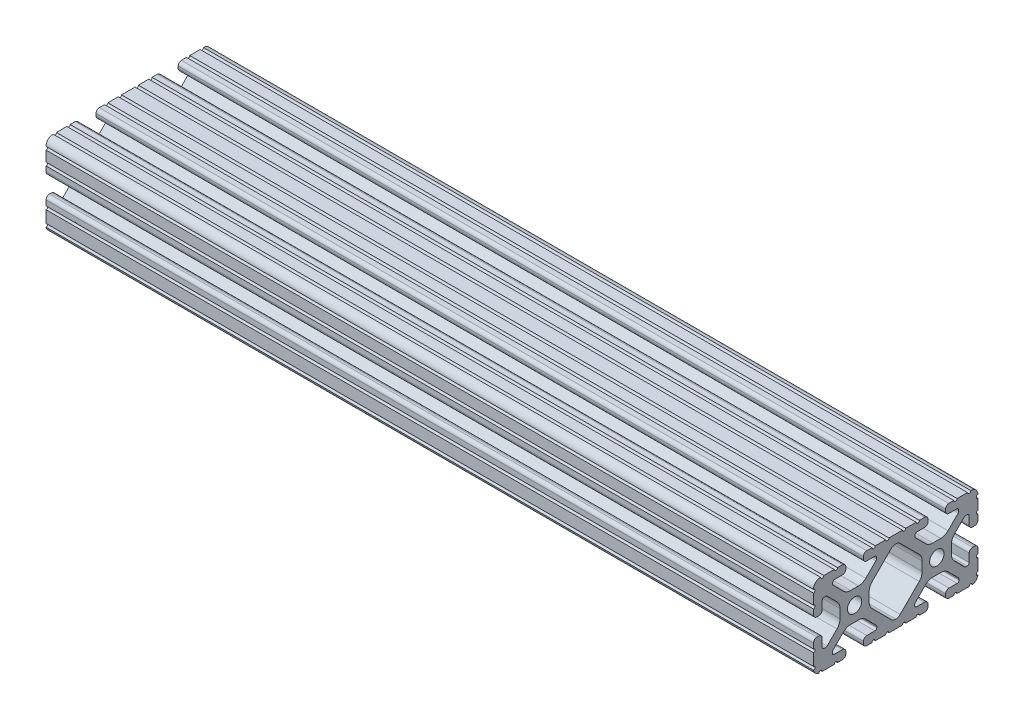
SolidWorks part; units mm, degrees
ref_plane "Front" through (0, 0, 0) normal (0, 0, 1) x (1, 0, 0)
ref_plane "Top" through (0, 0, 0) normal (0, 1, 0) x (1, 0, 0)
ref_plane "Right" through (0, 0, 0) normal (1, 0, 0) x (0, 0, -1)
sketch "Sketch1" plane through (0, 0, 0) normal (1, 0, 0) x (0, 0, -1)
  line L2 (30.3513, 26.5282) -> (39.1767, 35.3536)
  line L3 (40.5679, 38.7122) -> (40.5679, 42.8592)
  line L4 (39.1767, 46.2178) -> (30.3513, 55.0433)
  line L5 (26.1972, 55.0433) -> (17.3719, 46.2178)
  line L6 (15.9807, 42.8592) -> (15.9807, 38.7122)
  line L7 (17.3719, 35.3536) -> (26.1972, 26.5282)
  line L8 (37.19, 54.3201) -> (37.19, 54.8827)
  line L9 (38.079, 55.7717) -> (41.6855, 55.7717)
  line L10 (43.2603, 57.3465) -> (43.2603, 58.2825)
  line L11 (41.707, 59.8357) -> (39.2718, 59.8357)
  line L12 (37.7478, 59.8357) -> (32.9194, 59.8357)
  line L13 (31.3954, 59.8357) -> (25.1532, 59.8357)
  line L14 (23.6292, 59.8357) -> (18.8007, 59.8357)
  line L15 (17.2767, 59.8357) -> (14.8415, 59.8357)
  line L16 (13.2883, 58.2825) -> (13.2883, 57.3465)
  line L17 (14.8631, 55.7717) -> (18.4695, 55.7717)
  line L18 (19.3585, 54.8827) -> (19.3585, 54.3201)
  line L19 (19.0981, 53.6915) -> (14.4218, 49.0151)
  line L20 (11.0632, 47.6239) -> (7.3854, 47.6239)
  line L21 (4.0268, 49.0151) -> (-0.6496, 53.6915)
  line L22 (-0.91, 54.3201) -> (-0.91, 54.8827)
  line L23 (-0.021, 55.7717) -> (3.5855, 55.7717)
  line L24 (5.1603, 57.3465) -> (5.1603, 58.2663)
  line L25 (3.7154, 59.8357) -> (1.3285, 59.8357)
  line L26 (-0.1955, 59.8357) -> (-5.022, 59.8357)
  line L27 (-9.8257, 55.1609) -> (-9.8257, 50.3354)
  line L28 (-9.8257, 48.8114) -> (-9.8257, 46.4245)
  line L29 (-8.2509, 44.8497) -> (-7.3365, 44.8497)
  line L30 (-5.7617, 46.4245) -> (-5.7617, 50.1837)
  line L31 (-4.8727, 51.0727) -> (-4.1464, 51.0727)
  line L32 (-3.5178, 50.8123) -> (1.0767, 46.2178)
  line L33 (2.4679, 42.8592) -> (2.4679, 38.7122)
  line L34 (1.0767, 35.3536) -> (-3.5178, 30.7591)
  line L35 (-4.1464, 30.4987) -> (-4.8727, 30.4987)
  line L36 (-5.7617, 31.3877) -> (-5.7617, 35.1469)
  line L37 (-7.3365, 36.7217) -> (-8.2509, 36.7217)
  line L38 (-9.8257, 35.1469) -> (-9.8257, 32.76)
  line L39 (-9.8257, 31.236) -> (-9.8257, 25.7497)
  line L40 (-5.773, 21.7357) -> (-0.1955, 21.7357)
  line L41 (1.3285, 21.7357) -> (3.5855, 21.7357)
  line L42 (5.1603, 23.3105) -> (5.1603, 24.2249)
  line L43 (3.5855, 25.7997) -> (-0.1737, 25.7997)
  line L44 (-1.0627, 26.6887) -> (-1.0627, 27.0985)
  line L45 (-0.8023, 27.7272) -> (4.0268, 32.5563)
  line L46 (7.3854, 33.9475) -> (11.0632, 33.9475)
  line L47 (14.4218, 32.5563) -> (19.2509, 27.7272)
  line L48 (19.5113, 27.0985) -> (19.5113, 26.6887)
  line L49 (18.6223, 25.7997) -> (14.8631, 25.7997)
  line L50 (13.2883, 24.2249) -> (13.2883, 23.3105)
  line L51 (14.8631, 21.7357) -> (17.2767, 21.7357)
  line L52 (18.8007, 21.7357) -> (23.6292, 21.7357)
  line L53 (25.1532, 21.7357) -> (31.3954, 21.7357)
  line L54 (32.9194, 21.7357) -> (37.7478, 21.7357)
  line L55 (39.2718, 21.7357) -> (41.6855, 21.7357)
  line L56 (43.2603, 23.3105) -> (43.2603, 24.2249)
  line L57 (41.6855, 25.7997) -> (37.9263, 25.7997)
  line L58 (37.0373, 26.6887) -> (37.0373, 27.0985)
  line L59 (37.2977, 27.7272) -> (42.1268, 32.5563)
  line L60 (45.4854, 33.9475) -> (49.1632, 33.9475)
  line L61 (52.5218, 32.5563) -> (57.3509, 27.7272)
  line L62 (57.6113, 27.0985) -> (57.6113, 26.6887)
  line L63 (56.7223, 25.7997) -> (52.9631, 25.7997)
  line L64 (51.3883, 24.2249) -> (51.3883, 23.3105)
  line L65 (52.9631, 21.7357) -> (55.2201, 21.7357)
  line L66 (56.7441, 21.7357) -> (62.3216, 21.7357)
  line L67 (66.3743, 25.7497) -> (66.3743, 31.236)
  line L68 (66.3743, 32.76) -> (66.3743, 35.1469)
  line L69 (64.7995, 36.7217) -> (63.8851, 36.7217)
  line L70 (62.3103, 35.1469) -> (62.3103, 31.3877)
  line L71 (61.4213, 30.4987) -> (60.6949, 30.4987)
  line L72 (60.0663, 30.7591) -> (55.4719, 35.3536)
  line L73 (54.0807, 38.7122) -> (54.0807, 42.8592)
  line L74 (55.4719, 46.2178) -> (60.0663, 50.8123)
  line L75 (60.6949, 51.0727) -> (61.4213, 51.0727)
  line L76 (62.3103, 50.1837) -> (62.3103, 46.4245)
  line L77 (63.8851, 44.8497) -> (64.7995, 44.8497)
  line L78 (66.3743, 46.4245) -> (66.3743, 48.8114)
  line L79 (66.3743, 50.3354) -> (66.3743, 55.1609)
  line L80 (61.5705, 59.8357) -> (56.7441, 59.8357)
  line L81 (55.2201, 59.8357) -> (52.8332, 59.8357)
  line L82 (51.3883, 58.2663) -> (51.3883, 57.3465)
  line L83 (52.9631, 55.7717) -> (56.5695, 55.7717)
  line L84 (57.4585, 54.8827) -> (57.4585, 54.3201)
  line L85 (57.1981, 53.6915) -> (52.5218, 49.0151)
  line L86 (49.1632, 47.6239) -> (45.4854, 47.6239)
  line L87 (42.1268, 49.0151) -> (37.4504, 53.6915)
  arc A0 (39.1767, 35.3536) -> (40.5679, 38.7122) centre (35.8181, 38.7122) ccw
  arc A1 (30.3513, 55.0433) -> (28.2743, 55.8988) centre (28.2858, 52.9778) ccw
  arc A2 (28.2743, 55.8988) -> (26.1972, 55.0433) centre (28.2627, 52.9778) ccw
  arc A3 (17.3719, 46.2178) -> (15.9807, 42.8592) centre (20.7305, 42.8592) ccw
  arc A4 (15.9807, 38.7122) -> (17.3719, 35.3536) centre (20.7305, 38.7122) ccw
  arc A5 (26.1972, 26.5282) -> (28.2743, 25.6726) centre (28.2627, 28.5936) ccw
  arc A6 (28.2743, 25.6726) -> (30.3513, 26.5282) centre (28.2858, 28.5936) ccw
  circle A7 centre (47.3243, 40.7857) radius 3.3274
  circle A8 centre (9.2243, 40.7857) radius 3.3274
  arc A9 (40.5679, 42.8592) -> (39.1767, 46.2178) centre (35.8181, 42.8592) ccw
  arc A10 (38.079, 55.7717) -> (37.19, 54.8827) centre (38.079, 54.8827) ccw
  arc A11 (41.6855, 55.7717) -> (43.2603, 57.3465) centre (41.6855, 57.3465) ccw
  arc A12 (43.2603, 58.2825) -> (41.707, 59.8357) centre (41.707, 58.2825) ccw
  arc A13 (37.7478, 59.8357) -> (39.2718, 59.8357) centre (38.5098, 59.8357) ccw
  arc A14 (31.3954, 59.8357) -> (32.9194, 59.8357) centre (32.1574, 59.8357) ccw
  arc A15 (23.6292, 59.8357) -> (25.1532, 59.8357) centre (24.3912, 59.8357) ccw
  arc A16 (17.2767, 59.8357) -> (18.8007, 59.8357) centre (18.0387, 59.8357) ccw
  arc A17 (14.8415, 59.8357) -> (13.2883, 58.2825) centre (14.8415, 58.2825) ccw
  arc A18 (13.2883, 57.3465) -> (14.8631, 55.7717) centre (14.8631, 57.3465) ccw
  arc A19 (19.3585, 54.8827) -> (18.4695, 55.7717) centre (18.4695, 54.8827) ccw
  arc A20 (19.0981, 53.6915) -> (19.3585, 54.3201) centre (18.4695, 54.3201) ccw
  arc A21 (11.0632, 47.6239) -> (14.4218, 49.0151) centre (11.0632, 52.3737) ccw
  arc A22 (4.0268, 49.0151) -> (7.3854, 47.6239) centre (7.3854, 52.3737) ccw
  arc A23 (-0.91, 54.3201) -> (-0.6496, 53.6915) centre (-0.021, 54.3201) ccw
  arc A24 (-0.021, 55.7717) -> (-0.91, 54.8827) centre (-0.021, 54.8827) ccw
  arc A25 (3.5855, 55.7717) -> (5.1603, 57.3465) centre (3.5855, 57.3465) ccw
  arc A26 (5.1603, 58.2663) -> (3.7154, 59.8357) centre (3.5855, 58.2663) ccw
  arc A27 (-0.1955, 59.8357) -> (1.3285, 59.8357) centre (0.5665, 59.8357) ccw
  arc A28 (-6.5453, 59.8825) -> (-5.022, 59.8357) centre (-5.7836, 59.8591) ccw
  arc A29 (-6.5453, 59.8825) -> (-9.8633, 56.684) centre (-6.6287, 56.6488) ccw
  arc A30 (-9.8257, 55.1609) -> (-9.8633, 56.684) centre (-9.8257, 55.9229) ccw
  arc A31 (-9.8257, 48.8114) -> (-9.8257, 50.3354) centre (-9.8257, 49.5734) ccw
  arc A32 (-9.8257, 46.4245) -> (-8.2509, 44.8497) centre (-8.2509, 46.4245) ccw
  arc A33 (-7.3365, 44.8497) -> (-5.7617, 46.4245) centre (-7.3365, 46.4245) ccw
  arc A34 (-4.8727, 51.0727) -> (-5.7617, 50.1837) centre (-4.8727, 50.1837) ccw
  arc A35 (-3.5178, 50.8123) -> (-4.1464, 51.0727) centre (-4.1464, 50.1837) ccw
  arc A36 (2.4679, 42.8592) -> (1.0767, 46.2178) centre (-2.2819, 42.8592) ccw
  arc A37 (1.0767, 35.3536) -> (2.4679, 38.7122) centre (-2.2819, 38.7122) ccw
  arc A38 (-4.1464, 30.4987) -> (-3.5178, 30.7591) centre (-4.1464, 31.3877) ccw
  arc A39 (-5.7617, 31.3877) -> (-4.8727, 30.4987) centre (-4.8727, 31.3877) ccw
  arc A40 (-5.7617, 35.1469) -> (-7.3365, 36.7217) centre (-7.3365, 35.1469) ccw
  arc A41 (-8.2509, 36.7217) -> (-9.8257, 35.1469) centre (-8.2509, 35.1469) ccw
  arc A42 (-9.8257, 31.236) -> (-9.8257, 32.76) centre (-9.8257, 31.998) ccw
  arc A43 (-9.8257, 24.2257) -> (-9.8257, 25.7497) centre (-9.8257, 24.9877) ccw
  arc A44 (-9.8257, 24.2257) -> (-7.297, 21.7357) centre (-6.6712, 24.9002) ccw
  arc A45 (-5.773, 21.7357) -> (-7.297, 21.7357) centre (-6.535, 21.7357) ccw
  arc A46 (1.3285, 21.7357) -> (-0.1955, 21.7357) centre (0.5665, 21.7357) ccw
  arc A47 (3.5855, 21.7357) -> (5.1603, 23.3105) centre (3.5855, 23.3105) ccw
  arc A48 (5.1603, 24.2249) -> (3.5855, 25.7997) centre (3.5855, 24.2249) ccw
  arc A49 (-1.0627, 26.6887) -> (-0.1737, 25.7997) centre (-0.1737, 26.6887) ccw
  arc A50 (-0.8023, 27.7272) -> (-1.0627, 27.0985) centre (-0.1737, 27.0985) ccw
  arc A51 (7.3854, 33.9475) -> (4.0268, 32.5563) centre (7.3854, 29.1977) ccw
  arc A52 (14.4218, 32.5563) -> (11.0632, 33.9475) centre (11.0632, 29.1977) ccw
  arc A53 (19.5113, 27.0985) -> (19.2509, 27.7272) centre (18.6223, 27.0985) ccw
  arc A54 (18.6223, 25.7997) -> (19.5113, 26.6887) centre (18.6223, 26.6887) ccw
  arc A55 (14.8631, 25.7997) -> (13.2883, 24.2249) centre (14.8631, 24.2249) ccw
  arc A56 (13.2883, 23.3105) -> (14.8631, 21.7357) centre (14.8631, 23.3105) ccw
  arc A57 (18.8007, 21.7357) -> (17.2767, 21.7357) centre (18.0387, 21.7357) ccw
  arc A58 (25.1532, 21.7357) -> (23.6292, 21.7357) centre (24.3912, 21.7357) ccw
  arc A59 (32.9194, 21.7357) -> (31.3954, 21.7357) centre (32.1574, 21.7357) ccw
  arc A60 (39.2718, 21.7357) -> (37.7478, 21.7357) centre (38.5098, 21.7357) ccw
  arc A61 (41.6855, 21.7357) -> (43.2603, 23.3105) centre (41.6855, 23.3105) ccw
  arc A62 (43.2603, 24.2249) -> (41.6855, 25.7997) centre (41.6855, 24.2249) ccw
  arc A63 (37.0373, 26.6887) -> (37.9263, 25.7997) centre (37.9263, 26.6887) ccw
  arc A64 (37.2977, 27.7272) -> (37.0373, 27.0985) centre (37.9263, 27.0985) ccw
  arc A65 (45.4854, 33.9475) -> (42.1268, 32.5563) centre (45.4854, 29.1977) ccw
  arc A66 (52.5218, 32.5563) -> (49.1632, 33.9475) centre (49.1632, 29.1977) ccw
  arc A67 (57.6113, 27.0985) -> (57.3509, 27.7272) centre (56.7223, 27.0985) ccw
  arc A68 (56.7223, 25.7997) -> (57.6113, 26.6887) centre (56.7223, 26.6887) ccw
  arc A69 (52.9631, 25.7997) -> (51.3883, 24.2249) centre (52.9631, 24.2249) ccw
  arc A70 (51.3883, 23.3105) -> (52.9631, 21.7357) centre (52.9631, 23.3105) ccw
  arc A71 (56.7441, 21.7357) -> (55.2201, 21.7357) centre (55.9821, 21.7357) ccw
  arc A72 (63.8456, 21.7357) -> (62.3216, 21.7357) centre (63.0836, 21.7357) ccw
  arc A73 (63.8456, 21.7357) -> (66.3743, 24.2257) centre (63.2122, 24.9079) ccw
  arc A74 (66.3743, 25.7497) -> (66.3743, 24.2257) centre (66.3743, 24.9877) ccw
  arc A75 (66.3743, 32.76) -> (66.3743, 31.236) centre (66.3743, 31.998) ccw
  arc A76 (66.3743, 35.1469) -> (64.7995, 36.7217) centre (64.7995, 35.1469) ccw
  arc A77 (63.8851, 36.7217) -> (62.3103, 35.1469) centre (63.8851, 35.1469) ccw
  arc A78 (61.4213, 30.4987) -> (62.3103, 31.3877) centre (61.4213, 31.3877) ccw
  arc A79 (60.0663, 30.7591) -> (60.6949, 30.4987) centre (60.6949, 31.3877) ccw
  arc A80 (54.0807, 38.7122) -> (55.4719, 35.3536) centre (58.8305, 38.7122) ccw
  arc A81 (55.4719, 46.2178) -> (54.0807, 42.8592) centre (58.8305, 42.8592) ccw
  arc A82 (60.6949, 51.0727) -> (60.0663, 50.8123) centre (60.6949, 50.1837) ccw
  arc A83 (62.3103, 50.1837) -> (61.4213, 51.0727) centre (61.4213, 50.1837) ccw
  arc A84 (62.3103, 46.4245) -> (63.8851, 44.8497) centre (63.8851, 46.4245) ccw
  arc A85 (64.7995, 44.8497) -> (66.3743, 46.4245) centre (64.7995, 46.4245) ccw
  arc A86 (66.3743, 50.3354) -> (66.3743, 48.8114) centre (66.3743, 49.5734) ccw
  arc A87 (66.4119, 56.684) -> (66.3743, 55.1609) centre (66.3743, 55.9229) ccw
  arc A88 (66.4119, 56.684) -> (63.0938, 59.8825) centre (63.1773, 56.6488) ccw
  arc A89 (61.5705, 59.8357) -> (63.0938, 59.8825) centre (62.3322, 59.8591) ccw
  arc A90 (55.2201, 59.8357) -> (56.7441, 59.8357) centre (55.9821, 59.8357) ccw
  arc A91 (52.8332, 59.8357) -> (51.3883, 58.2663) centre (52.9631, 58.2663) ccw
  arc A92 (51.3883, 57.3465) -> (52.9631, 55.7717) centre (52.9631, 57.3465) ccw
  arc A93 (57.4585, 54.8827) -> (56.5695, 55.7717) centre (56.5695, 54.8827) ccw
  arc A94 (57.1981, 53.6915) -> (57.4585, 54.3201) centre (56.5695, 54.3201) ccw
  arc A95 (49.1632, 47.6239) -> (52.5218, 49.0151) centre (49.1632, 52.3737) ccw
  arc A96 (42.1268, 49.0151) -> (45.4854, 47.6239) centre (45.4854, 52.3737) ccw
  arc A97 (37.19, 54.3201) -> (37.4504, 53.6915) centre (38.079, 54.3201) ccw
extrude "Extrude1" add sketch "Sketch1" along normal blind 355.6
